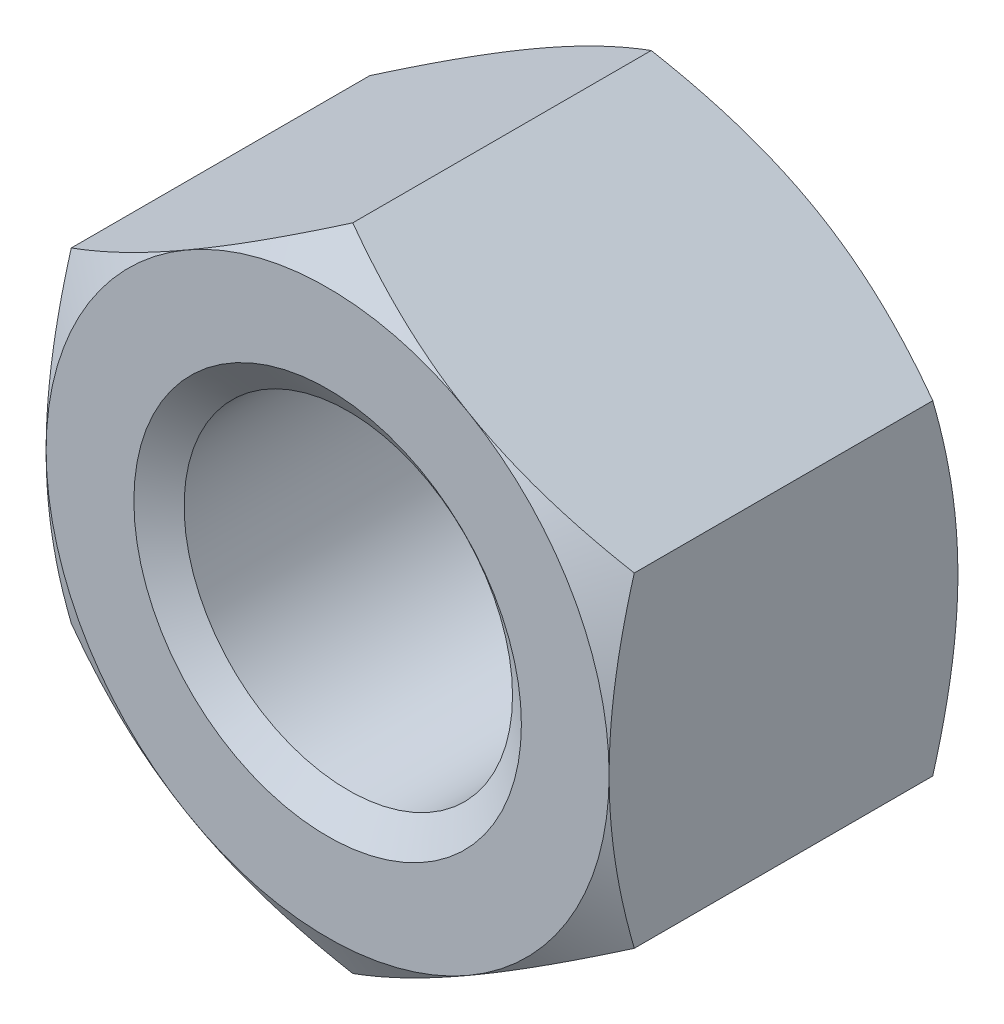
SolidWorks part; units mm, degrees
ref_plane "Plane1" through (0, 0, 0) normal (0, 0, 1) x (1, 0, 0)
ref_plane "Plane2" through (0, 0, 0) normal (0, 1, 0) x (1, 0, 0)
ref_plane "Plane3" through (0, 0, 0) normal (1, 0, 0) x (0, 0, -1)
sketch "BaseNutSke" plane through (0, 0, 0) normal (0, 0, 1) x (1, 0, 0)
  line L6 (18, 10.3923) -> (18, -10.3923)
  line L7 (-18, 10.3923) -> (-18, -10.3923)
  line L8 (18, 10.3923) -> (0, 20.7846)
  line L9 (0, 20.7846) -> (-18, 10.3923)
  line L10 (-18, -10.3923) -> (0, -20.7846)
  line L11 (0, -20.7846) -> (18, -10.3923)
  circle A0 centre (0, 0) radius 10.5
  dimension "D4" = 18
  dimension "Tap_drill" = 21
  dimension "D1" = 120
  dimension "D2" = 18
  dimension "D3" = 18
  dimension "Width_flats" = 36
extrude "BaseNut" add sketch "BaseNutSke" against normal blind 22.3
sketch "Sketch3" plane through (0, 0, 0) normal (1, 0, 0) x (0, 0, -1)
  line L0 (22.3, 18) -> (20.6923, 20.7846)
  line L1 (20.6923, 20.7846) -> (20.6923, 30.7846)
  line L2 (20.6923, 30.7846) -> (32.3, 30.7846)
  line L3 (32.3, 30.7846) -> (32.3, 18)
  line L4 (32.3, 18) -> (22.3, 18)
  line L5 (22.3, 10.3923) -> (22.3, 20.7846) construction
  line L6 (22.3, 20.7846) -> (0, 20.7846) construction
  line L7 (0, 0) -> (38.6776, 0) construction
  line L8 (22.3, 0) -> (0, 0) construction
  line L9 (11.15, 20.7846) -> (11.15, 44.222) construction
  line L10 (1.6077, 30.7846) -> (-10, 30.7846)
  line L11 (-10, 30.7846) -> (-10, 18)
  line L12 (-10, 18) -> (0, 18)
  line L13 (0, 18) -> (1.6077, 20.7846)
  line L14 (1.6077, 20.7846) -> (1.6077, 30.7846)
  line L15 (22.3, 20.7846) -> (0, 20.7846) construction
  line L16 (22.3, 20.7846) -> (0, 20.7846) construction
  dimension "D1" = 18
  dimension "D2" = 30
  dimension "D3" = 10
  dimension "D4" = 10
revolve "Double-Chamfer" cut sketch "Sketch3" angle 360 about L7
sketch "Sketch5"
  line L0 (22.3, 12.39) -> (20.9766, 10.5)
  line L2 (22.3, 12.39) -> (22.3, 10.5)
  line L3 (22.3, 10.5) -> (20.9766, 10.5)
  line L7 (0, 12.39) -> (1.3234, 10.5)
  line L9 (1.3234, 10.5) -> (0, 10.5)
  line L10 (0, 10.5) -> (0, 12.39)
  line L11 (25.0375, 0) -> (38.388, 0) construction
  line L12 (22.3, 0) -> (0, 0) construction
revolve "ThreadSchematic" cut sketch "ThdSchSke" angle 360 about L6
sketch "ThdSchSke" plane through (0, 0, 0) normal (0, 1, 0) x (1, 0, 0)
  line L0 (-12, 2.3737) -> (-10.5, 3.424)
  line L1 (-10.5, 3.424) -> (-5.25, 3.424)
  line L2 (-5.25, 3.424) -> (-5.25, 1.3234)
  line L3 (-5.25, 1.3234) -> (-10.5, 1.3234)
  line L4 (-10.5, 1.3234) -> (-12, 2.3737)
  line L5 (-1.5, 22.6821) -> (1.5, 22.6821) construction
  line L6 (0, 22.6821) -> (0, -2.9874) construction
  line L7 (0, 20.9766) -> (0, 1.3234) construction
  dimension "VeeAngle" = 70
  dimension "SideAngle" = 55
  dimension "OverCut" = 10.5
  dimension "Advance" = 3
  dimension "Thread_major" = 24
revolve "EndChamfer" cut sketch "Sketch5" angle 360 about L11
pattern_linear "ThdSchPat" [suppressed] count 7 spacing 3
equation "\"D2@BaseNutSke\" = \"Width_flats@BaseNutSke\" / 2"
equation "\"D3@BaseNutSke\" = \"Width_flats@BaseNutSke\" / 2"
equation "\"D1@Sketch3\" = \"Width_flats@BaseNutSke\" /2"
equation "\"D4@BaseNutSke\" = \"D3@BaseNutSke\""
equation "\"D2@Sketch5\" = \"Tap_drill@BaseNutSke\"*1.18"
equation "\"Thread_major@ThdSchSke\" = \"Thread_major@ThreadCosmetic\""
equation "\"D3@ThdSchPat\" = \"Advance@ThdSchSke\""
equation "\"D1@ThdSchPat\" =  int( \"Thickness@BaseNut\"/\"Advance@ThdSchSke\" ) "
equation "\"OverCut@ThdSchSke\" = \"Tap_drill@BaseNutSke\"/2"
